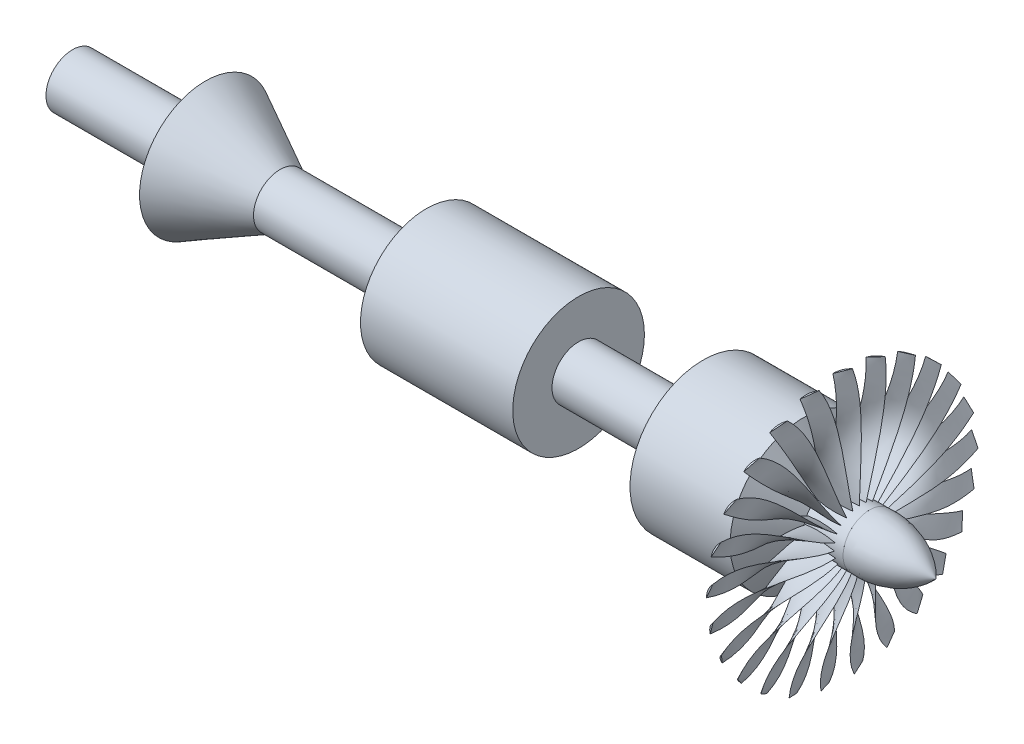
SolidWorks part; units mm, degrees
ref_plane "Front Plane" through (0, 0, 0) normal (0, 0, 1) x (1, 0, 0)
ref_plane "Top Plane" through (0, 0, 0) normal (0, 1, 0) x (1, 0, 0)
ref_plane "Right Plane" through (0, 0, 0) normal (1, 0, 0) x (0, 0, -1)
sketch "Sketch1" plane through (0, 0, 0) normal (0, 0, 1) x (1, 0, 0)
  line L0 (0, 0) -> (0, 20)
  line L1 (0, 20) -> (100, 20)
  line L2 (100, 20) -> (100, 49.5549)
  line L3 (100, 49.5549) -> (156.2123, 20)
  line L4 (156.2123, 20) -> (266.319, 20)
  line L5 (266.319, 20) -> (266.319, 49.5549)
  line L6 (266.319, 49.5549) -> (380.9179, 49.5549)
  line L7 (380.9179, 49.5549) -> (380.9179, 20)
  line L8 (380.9179, 20) -> (456.2541, 20)
  line L9 (456.2541, 20) -> (474.6838, 55.0527)
  line L10 (474.6838, 55.0527) -> (549.9722, 55.0527)
  line L11 (549.9722, 55.0527) -> (570, 20)
  line L12 (570, 20) -> (600, 20)
  line L13 (600, 20) -> (600, 0)
  line L14 (600, 0) -> (0, 0)
  dimension "D1" = 600
  dimension "D2" = 20
  dimension "D3" = 20
  dimension "D4" = 100
  dimension "D5" = 30
revolve "Revolve1" add sketch "Sketch1" angle 360 about L14
ref_plane "Plane1" through (0, 100, 0) normal (0, 1, 0) x (1, 0, 0)
sketch "Sketch3" plane through (0, 0, 0) normal (0, 1, 0) x (1, 0, 0)
  line L0 (600, 0) -> (427.5169, 0) construction
  line L1 (600, -20) -> (600, 20) construction
  spline S0 degree 2 poles (572.7602, 0) (582.8174, 2.0204) (592.8338, 0) knots 0 0 0 1 1 1
  spline S1 degree 2 poles (572.7602, 0) (582.8174, -2.0204) (592.8338, 0) knots 0 0 0 1 1 1
  dimension "D1" = 2
sketch "Sketch4" plane through (0, 100, 0) normal (0, 1, 0) x (1, 0, 0)
  line L0 (600, 0) -> (427.5169, 0) construction
  spline S0 degree 2 poles (581.4087, 5.5725) (577.0762, 1.1206) (577.2986, -4.9598) knots 0 0 0 1 1 1
  spline S1 degree 2 poles (581.4087, 5.5725) (579.2232, 0.3571) (577.2986, -4.9598) knots 0 0 0 1 1 1
sketch3d "3DSketch1"
  spline S0 degree 3 poles (577.2986, 100, 4.9598) (587.9775, 68.3867, 6.6008) (564.4364, 33.5136, -0.001) (572.7602, 0, 0) knots 0 0 0 0 1 1 1 1
  spline S1 degree 3 poles (592.8338, 0, 0) (597.4867, 33.7969, 7.6551) (583.2432, 68.3315, -16.6543) (581.4087, 100, -5.5725) knots 0 0 0 0 1 1 1 1
loft "Loft1" add profiles "Sketch4", "Sketch3"
pattern_circular "CirPattern1" count 25 over 360 about axis through (600, 0, 0) along (1, 0, 0) of "Loft1"
sketch "Sketch5" plane through (0, 0, 0) normal (0, 0, 1) x (1, 0, 0)
  line L0 (600, 0) -> (650, 0)
  line L1 (600, -20) -> (600, 20) construction
  arc A0 (600, 20) -> (650, 0) centre (604.5776, -41.0559) cw
  dimension "D1" = 50
revolve "Revolve-Thin4" add sketch "Sketch5" angle 360 about L0
